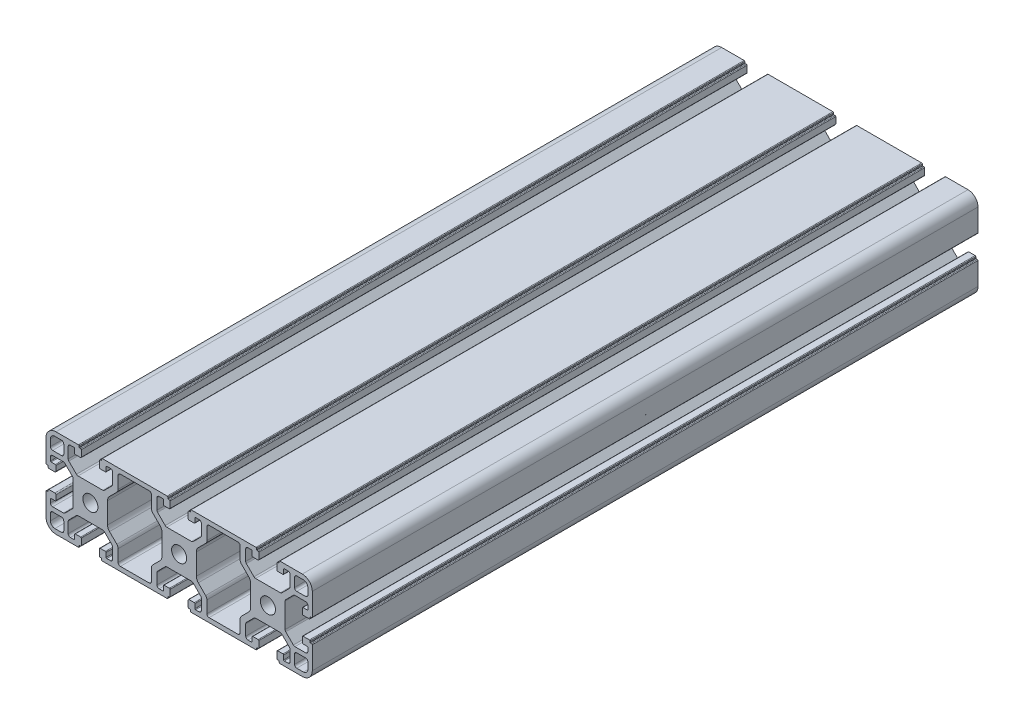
SolidWorks part; units mm, degrees
ref_plane "前视基准面" through (0, 0, 0) normal (0, 0, 1) x (1, 0, 0)
ref_plane "上视基准面" through (0, 0, 0) normal (0, 1, 0) x (1, 0, 0)
ref_plane "右视基准面" through (0, 0, 0) normal (1, 0, 0) x (0, 0, -1)
sketch "草图1" plane through (0, 0, 0) normal (0, 0, 1) x (1, 0, 0)
  line B0 (-34.432, 7.75) -> (-45.568, 7.75)
  line B1 (-46.2751, 8.0429) -> (-49.7071, 11.4749)
  line B2 (-50, 12.182) -> (-50, 17)
  line B3 (-49, 18) -> (-47.1, 18)
  line B4 (-47.1, 18) -> (-47.1, 15.8)
  line B5 (-46.8, 15.5) -> (-44.4, 15.5)
  line B6 (-44.1, 15.8) -> (-44.1, 18.7)
  line B7 (-44.4, 19) -> (-44.9, 19)
  line B8 (-45.1, 19.2) -> (-45.1, 19.7)
  line B9 (-45.4, 20) -> (-55.5, 20)
  line B10 (-60, 15.5) -> (-60, 5.4)
  line B11 (-59.7, 5.1) -> (-59.2, 5.1)
  line B12 (-59, 4.9) -> (-59, 4.4)
  line B13 (-58.7, 4.1) -> (-56, 4.1)
  line B14 (-55.5, 4.6) -> (-55.5, 6.8)
  line B15 (-55.8, 7.1) -> (-57.7, 7.1)
  line B16 (-58, 7.4) -> (-58, 9)
  line B17 (-57, 10) -> (-52.182, 10)
  line B18 (-51.4749, 9.7071) -> (-48.0429, 6.2751)
  line B19 (-47.75, 5.568) -> (-47.75, -5.568)
  line B20 (-48.0429, -6.2751) -> (-51.4749, -9.7071)
  line B21 (-52.182, -10) -> (-57, -10)
  line B22 (-58, -9) -> (-58, -7.4)
  line B23 (-57.7, -7.1) -> (-55.8, -7.1)
  line B24 (-55.5, -6.8) -> (-55.5, -4.6)
  line B25 (-56, -4.1) -> (-58.7, -4.1)
  line B26 (-59, -4.4) -> (-59, -4.9)
  line B27 (-59.2, -5.1) -> (-59.7, -5.1)
  line B28 (-60, -5.4) -> (-60, -15.5)
  line B29 (-55.5, -20) -> (-45.4, -20)
  line B30 (-45.1, -19.7) -> (-45.1, -19.2)
  line B31 (-44.9, -19) -> (-44.4, -19)
  line B32 (-44.1, -18.7) -> (-44.1, -15.8)
  line B33 (-44.4, -15.5) -> (-46.8, -15.5)
  line B34 (-47.1, -15.8) -> (-47.1, -17.7)
  line B35 (-47.4, -18) -> (-49, -18)
  line B36 (-50, -17) -> (-50, -12.182)
  line B37 (-49.7071, -11.4749) -> (-46.2751, -8.0429)
  line B38 (-45.568, -7.75) -> (-34.432, -7.75)
  line B39 (-33.7249, -8.0429) -> (-30.2929, -11.4749)
  line B40 (-30, -12.182) -> (-30, -17)
  line B41 (-31, -18) -> (-32.6, -18)
  line B42 (-32.9, -17.7) -> (-32.9, -15.8)
  line B43 (-33.2, -15.5) -> (-35.6, -15.5)
  line B44 (-35.9, -15.8) -> (-35.9, -18.7)
  line B45 (-35.6, -19) -> (-35.1, -19)
  line B46 (-34.9, -19.2) -> (-34.9, -19.7)
  line B47 (-34.6, -20) -> (-5.4, -20)
  line B48 (-5.1, -19.7) -> (-5.1, -19.2)
  line B49 (-4.9, -19) -> (-4.4, -19)
  line B50 (-4.1, -18.7) -> (-4.1, -15.8)
  line B51 (-4.4, -15.5) -> (-6.8, -15.5)
  line B52 (-7.1, -15.8) -> (-7.1, -17.7)
  line B53 (-7.4, -18) -> (-9, -18)
  line B54 (-10, -17) -> (-10, -12.182)
  line B55 (-9.7071, -11.4749) -> (-6.2751, -8.0429)
  line B56 (-5.568, -7.75) -> (5.568, -7.75)
  line B57 (6.2751, -8.0429) -> (9.7071, -11.4749)
  line B58 (10, -12.182) -> (10, -17)
  line B59 (9, -18) -> (7.4, -18)
  line B60 (7.1, -17.7) -> (7.1, -15.8)
  line B61 (6.8, -15.5) -> (4.4, -15.5)
  line B62 (4.1, -15.8) -> (4.1, -18.7)
  line B63 (4.4, -19) -> (4.9, -19)
  line B64 (5.1, -19.2) -> (5.1, -19.7)
  line B65 (5.4, -20) -> (34.6, -20)
  line B66 (34.9, -19.7) -> (34.9, -19.2)
  line B67 (35.1, -19) -> (35.6, -19)
  line B68 (35.9, -18.7) -> (35.9, -15.8)
  line B69 (35.6, -15.5) -> (33.2, -15.5)
  line B70 (32.9, -15.8) -> (32.9, -17.7)
  line B71 (32.6, -18) -> (31, -18)
  line B72 (30, -17) -> (30, -12.182)
  line B73 (30.2929, -11.4749) -> (33.7249, -8.0429)
  line B74 (34.432, -7.75) -> (45.568, -7.75)
  line B75 (46.2751, -8.0429) -> (49.7071, -11.4749)
  line B76 (50, -12.182) -> (50, -17)
  line B77 (49, -18) -> (47.4, -18)
  line B78 (47.1, -17.7) -> (47.1, -15.8)
  line B79 (46.8, -15.5) -> (44.4, -15.5)
  line B80 (44.1, -15.8) -> (44.1, -18.7)
  line B81 (44.4, -19) -> (44.9, -19)
  line B82 (45.1, -19.2) -> (45.1, -19.7)
  line B83 (45.4, -20) -> (55.5, -20)
  line B84 (60, -15.5) -> (60, -5.4)
  line B85 (59.7, -5.1) -> (59.2, -5.1)
  line B86 (59, -4.9) -> (59, -4.4)
  line B87 (58.7, -4.1) -> (55.8, -4.1)
  line B88 (55.5, -4.4) -> (55.5, -6.8)
  line B89 (55.8, -7.1) -> (57.7, -7.1)
  line B90 (58, -7.4) -> (58, -9)
  line B91 (57, -10) -> (52.182, -10)
  line B92 (51.4749, -9.7071) -> (48.0429, -6.2751)
  line B93 (47.75, -5.568) -> (47.75, 5.568)
  line B94 (48.0429, 6.2751) -> (51.4749, 9.7071)
  line B95 (52.182, 10) -> (57, 10)
  line B96 (58, 9) -> (58, 7.4)
  line B97 (57.7, 7.1) -> (55.8, 7.1)
  line B98 (55.5, 6.8) -> (55.5, 4.4)
  line B99 (55.8, 4.1) -> (58.7, 4.1)
  line B100 (59, 4.4) -> (59, 4.9)
  line B101 (59.2, 5.1) -> (59.7, 5.1)
  line B102 (60, 5.4) -> (60, 15.5)
  line B103 (55.5, 20) -> (45.4, 20)
  line B104 (45.1, 19.7) -> (45.1, 19.2)
  line B105 (44.9, 19) -> (44.4, 19)
  line B106 (44.1, 18.7) -> (44.1, 15.8)
  line B107 (44.4, 15.5) -> (46.8, 15.5)
  line B108 (47.1, 15.8) -> (47.1, 17.7)
  line B109 (47.4, 18) -> (49, 18)
  line B110 (50, 17) -> (50, 12.182)
  line B111 (49.7071, 11.4749) -> (46.2751, 8.0429)
  line B112 (45.568, 7.75) -> (34.432, 7.75)
  line B113 (33.7249, 8.0429) -> (30.2929, 11.4749)
  line B114 (30, 12.182) -> (30, 17)
  line B115 (31, 18) -> (32.6, 18)
  line B116 (32.9, 17.7) -> (32.9, 15.8)
  line B117 (33.2, 15.5) -> (35.6, 15.5)
  line B118 (35.9, 15.8) -> (35.9, 18.7)
  line B119 (35.6, 19) -> (35.1, 19)
  line B120 (34.9, 19.2) -> (34.9, 19.7)
  line B121 (34.6, 20) -> (5.4, 20)
  line B122 (5.1, 19.7) -> (5.1, 19.2)
  line B123 (4.9, 19) -> (4.4, 19)
  line B124 (4.1, 18.7) -> (4.1, 15.8)
  line B125 (4.4, 15.5) -> (6.8, 15.5)
  line B126 (7.1, 15.8) -> (7.1, 17.7)
  line B127 (7.4, 18) -> (9, 18)
  line B128 (10, 17) -> (10, 12.182)
  line B129 (9.7071, 11.4749) -> (6.2751, 8.0429)
  line B130 (5.568, 7.75) -> (-5.568, 7.75)
  line B131 (-6.2751, 8.0429) -> (-9.7071, 11.4749)
  line B132 (-10, 12.182) -> (-10, 17)
  line B133 (-9, 18) -> (-7.4, 18)
  line B134 (-7.1, 17.7) -> (-7.1, 15.8)
  line B135 (-6.8, 15.5) -> (-4.4, 15.5)
  line B136 (-4.1, 15.8) -> (-4.1, 18.7)
  line B137 (-4.4, 19) -> (-4.9, 19)
  line B138 (-5.1, 19.2) -> (-5.1, 19.7)
  line B139 (-5.4, 20) -> (-34.6, 20)
  line B140 (-34.9, 19.7) -> (-34.9, 19.2)
  line B141 (-35.1, 19) -> (-35.6, 19)
  line B142 (-35.9, 18.7) -> (-35.9, 15.8)
  line B143 (-35.6, 15.5) -> (-33.2, 15.5)
  line B144 (-32.9, 15.8) -> (-32.9, 17.7)
  line B145 (-32.6, 18) -> (-31, 18)
  line B146 (-30, 17) -> (-30, 12.182)
  line B147 (-30.2929, 11.4749) -> (-33.7249, 8.0429)
  line B148 (11.9277, 10.1599) -> (8.6287, 6.8609)
  line B149 (7.75, 4.7396) -> (7.75, -4.7396)
  line B150 (8.6287, -6.8609) -> (11.9277, -10.1599)
  line B151 (12.5135, -11.5741) -> (12.5135, -17)
  line B152 (13.5135, -18) -> (26.4865, -18)
  line B153 (27.4865, -17) -> (27.4865, -11.5741)
  line B154 (28.0723, -10.1599) -> (31.3713, -6.8609)
  line B155 (32.25, -4.7396) -> (32.25, 4.7396)
  line B156 (31.3713, 6.8609) -> (28.0723, 10.1599)
  line B157 (27.4865, 11.5741) -> (27.4865, 17)
  line B158 (26.4865, 18) -> (13.5135, 18)
  line B159 (12.5135, 17) -> (12.5135, 11.5741)
  line B160 (-28.0723, 10.1599) -> (-31.3713, 6.8609)
  line B161 (-32.25, 4.7396) -> (-32.25, -4.7396)
  line B162 (-31.3713, -6.8609) -> (-28.0723, -10.1599)
  line B163 (-27.4865, -11.5741) -> (-27.4865, -17)
  line B164 (-26.4865, -18) -> (-13.5135, -18)
  line B165 (-12.5135, -17) -> (-12.5135, -11.5741)
  line B166 (-11.9277, -10.1599) -> (-8.6287, -6.8609)
  line B167 (-7.75, -4.7396) -> (-7.75, 4.7396)
  line B168 (-8.6287, 6.8609) -> (-11.9277, 10.1599)
  line B169 (-12.5135, 11.5741) -> (-12.5135, 17)
  line B170 (-13.5135, 18) -> (-26.4865, 18)
  line B171 (-27.4865, 17) -> (-27.4865, 11.5741)
  line B172 (58, -16) -> (58, -13)
  line B173 (57, -12) -> (53, -12)
  line B174 (52, -13) -> (52, -17)
  line B175 (53, -18) -> (56, -18)
  line B176 (52, 17) -> (52, 13)
  line B177 (53, 12) -> (57, 12)
  line B178 (58, 13) -> (58, 16)
  line B179 (56, 18) -> (53, 18)
  line B180 (-57, 12) -> (-53, 12)
  line B181 (-52, 13) -> (-52, 17)
  line B182 (-53, 18) -> (-56, 18)
  line B183 (-58, 16) -> (-58, 13)
  line B184 (-58, -13) -> (-58, -16)
  line B185 (-56, -18) -> (-53, -18)
  line B186 (-52, -17) -> (-52, -13)
  line B187 (-53, -12) -> (-57, -12)
  arc B188 (-34.432, 7.75) -> (-33.7249, 8.0429) centre (-34.432, 8.75) ccw
  arc B189 (-46.2751, 8.0429) -> (-45.568, 7.75) centre (-45.568, 8.75) ccw
  arc B190 (-50, 12.182) -> (-49.7071, 11.4749) centre (-49, 12.182) ccw
  arc B191 (-49, 18) -> (-50, 17) centre (-49, 17) ccw
  arc B192 (-47.1, 15.8) -> (-46.8, 15.5) centre (-46.8, 15.8) ccw
  arc B193 (-44.4, 15.5) -> (-44.1, 15.8) centre (-44.4, 15.8) ccw
  arc B194 (-44.1, 18.7) -> (-44.4, 19) centre (-44.4, 18.7) ccw
  arc B195 (-45.1, 19.2) -> (-44.9, 19) centre (-44.9, 19.2) ccw
  arc B196 (-45.1, 19.7) -> (-45.4, 20) centre (-45.4, 19.7) ccw
  arc B197 (-55.5, 20) -> (-60, 15.5) centre (-55.5, 15.5) ccw
  arc B198 (-60, 5.4) -> (-59.7, 5.1) centre (-59.7, 5.4) ccw
  arc B199 (-59, 4.9) -> (-59.2, 5.1) centre (-59.2, 4.9) ccw
  arc B200 (-59, 4.4) -> (-58.7, 4.1) centre (-58.7, 4.4) ccw
  arc B201 (-56, 4.1) -> (-55.5, 4.6) centre (-56, 4.6) ccw
  arc B202 (-55.5, 6.8) -> (-55.8, 7.1) centre (-55.8, 6.8) ccw
  arc B203 (-58, 7.4) -> (-57.7, 7.1) centre (-57.7, 7.4) ccw
  arc B204 (-57, 10) -> (-58, 9) centre (-57, 9) ccw
  arc B205 (-51.4749, 9.7071) -> (-52.182, 10) centre (-52.182, 9) ccw
  arc B206 (-47.75, 5.568) -> (-48.0429, 6.2751) centre (-48.75, 5.568) ccw
  arc B207 (-48.0429, -6.2751) -> (-47.75, -5.568) centre (-48.75, -5.568) ccw
  arc B208 (-52.182, -10) -> (-51.4749, -9.7071) centre (-52.182, -9) ccw
  arc B209 (-58, -9) -> (-57, -10) centre (-57, -9) ccw
  arc B210 (-57.7, -7.1) -> (-58, -7.4) centre (-57.7, -7.4) ccw
  arc B211 (-55.8, -7.1) -> (-55.5, -6.8) centre (-55.8, -6.8) ccw
  arc B212 (-55.5, -4.6) -> (-56, -4.1) centre (-56, -4.6) ccw
  arc B213 (-58.7, -4.1) -> (-59, -4.4) centre (-58.7, -4.4) ccw
  arc B214 (-59.2, -5.1) -> (-59, -4.9) centre (-59.2, -4.9) ccw
  arc B215 (-59.7, -5.1) -> (-60, -5.4) centre (-59.7, -5.4) ccw
  arc B216 (-60, -15.5) -> (-55.5, -20) centre (-55.5, -15.5) ccw
  arc B217 (-45.4, -20) -> (-45.1, -19.7) centre (-45.4, -19.7) ccw
  arc B218 (-44.9, -19) -> (-45.1, -19.2) centre (-44.9, -19.2) ccw
  arc B219 (-44.4, -19) -> (-44.1, -18.7) centre (-44.4, -18.7) ccw
  arc B220 (-44.1, -15.8) -> (-44.4, -15.5) centre (-44.4, -15.8) ccw
  arc B221 (-46.8, -15.5) -> (-47.1, -15.8) centre (-46.8, -15.8) ccw
  arc B222 (-47.4, -18) -> (-47.1, -17.7) centre (-47.4, -17.7) ccw
  arc B223 (-50, -17) -> (-49, -18) centre (-49, -17) ccw
  arc B224 (-49.7071, -11.4749) -> (-50, -12.182) centre (-49, -12.182) ccw
  arc B225 (-45.568, -7.75) -> (-46.2751, -8.0429) centre (-45.568, -8.75) ccw
  arc B226 (-33.7249, -8.0429) -> (-34.432, -7.75) centre (-34.432, -8.75) ccw
  arc B227 (-30, -12.182) -> (-30.2929, -11.4749) centre (-31, -12.182) ccw
  arc B228 (-31, -18) -> (-30, -17) centre (-31, -17) ccw
  arc B229 (-32.9, -17.7) -> (-32.6, -18) centre (-32.6, -17.7) ccw
  arc B230 (-32.9, -15.8) -> (-33.2, -15.5) centre (-33.2, -15.8) ccw
  arc B231 (-35.6, -15.5) -> (-35.9, -15.8) centre (-35.6, -15.8) ccw
  arc B232 (-35.9, -18.7) -> (-35.6, -19) centre (-35.6, -18.7) ccw
  arc B233 (-34.9, -19.2) -> (-35.1, -19) centre (-35.1, -19.2) ccw
  arc B234 (-34.9, -19.7) -> (-34.6, -20) centre (-34.6, -19.7) ccw
  arc B235 (-5.4, -20) -> (-5.1, -19.7) centre (-5.4, -19.7) ccw
  arc B236 (-4.9, -19) -> (-5.1, -19.2) centre (-4.9, -19.2) ccw
  arc B237 (-4.4, -19) -> (-4.1, -18.7) centre (-4.4, -18.7) ccw
  arc B238 (-4.1, -15.8) -> (-4.4, -15.5) centre (-4.4, -15.8) ccw
  arc B239 (-6.8, -15.5) -> (-7.1, -15.8) centre (-6.8, -15.8) ccw
  arc B240 (-7.4, -18) -> (-7.1, -17.7) centre (-7.4, -17.7) ccw
  arc B241 (-10, -17) -> (-9, -18) centre (-9, -17) ccw
  arc B242 (-9.7071, -11.4749) -> (-10, -12.182) centre (-9, -12.182) ccw
  arc B243 (-5.568, -7.75) -> (-6.2751, -8.0429) centre (-5.568, -8.75) ccw
  arc B244 (6.2751, -8.0429) -> (5.568, -7.75) centre (5.568, -8.75) ccw
  arc B245 (10, -12.182) -> (9.7071, -11.4749) centre (9, -12.182) ccw
  arc B246 (9, -18) -> (10, -17) centre (9, -17) ccw
  arc B247 (7.1, -17.7) -> (7.4, -18) centre (7.4, -17.7) ccw
  arc B248 (7.1, -15.8) -> (6.8, -15.5) centre (6.8, -15.8) ccw
  arc B249 (4.4, -15.5) -> (4.1, -15.8) centre (4.4, -15.8) ccw
  arc B250 (4.1, -18.7) -> (4.4, -19) centre (4.4, -18.7) ccw
  arc B251 (5.1, -19.2) -> (4.9, -19) centre (4.9, -19.2) ccw
  arc B252 (5.1, -19.7) -> (5.4, -20) centre (5.4, -19.7) ccw
  arc B253 (34.6, -20) -> (34.9, -19.7) centre (34.6, -19.7) ccw
  arc B254 (35.1, -19) -> (34.9, -19.2) centre (35.1, -19.2) ccw
  arc B255 (35.6, -19) -> (35.9, -18.7) centre (35.6, -18.7) ccw
  arc B256 (35.9, -15.8) -> (35.6, -15.5) centre (35.6, -15.8) ccw
  arc B257 (33.2, -15.5) -> (32.9, -15.8) centre (33.2, -15.8) ccw
  arc B258 (32.6, -18) -> (32.9, -17.7) centre (32.6, -17.7) ccw
  arc B259 (30, -17) -> (31, -18) centre (31, -17) ccw
  arc B260 (30.2929, -11.4749) -> (30, -12.182) centre (31, -12.182) ccw
  arc B261 (34.432, -7.75) -> (33.7249, -8.0429) centre (34.432, -8.75) ccw
  arc B262 (46.2751, -8.0429) -> (45.568, -7.75) centre (45.568, -8.75) ccw
  arc B263 (50, -12.182) -> (49.7071, -11.4749) centre (49, -12.182) ccw
  arc B264 (49, -18) -> (50, -17) centre (49, -17) ccw
  arc B265 (47.1, -17.7) -> (47.4, -18) centre (47.4, -17.7) ccw
  arc B266 (47.1, -15.8) -> (46.8, -15.5) centre (46.8, -15.8) ccw
  arc B267 (44.4, -15.5) -> (44.1, -15.8) centre (44.4, -15.8) ccw
  arc B268 (44.1, -18.7) -> (44.4, -19) centre (44.4, -18.7) ccw
  arc B269 (45.1, -19.2) -> (44.9, -19) centre (44.9, -19.2) ccw
  arc B270 (45.1, -19.7) -> (45.4, -20) centre (45.4, -19.7) ccw
  arc B271 (55.5, -20) -> (60, -15.5) centre (55.5, -15.5) ccw
  arc B272 (60, -5.4) -> (59.7, -5.1) centre (59.7, -5.4) ccw
  arc B273 (59, -4.9) -> (59.2, -5.1) centre (59.2, -4.9) ccw
  arc B274 (59, -4.4) -> (58.7, -4.1) centre (58.7, -4.4) ccw
  arc B275 (55.8, -4.1) -> (55.5, -4.4) centre (55.8, -4.4) ccw
  arc B276 (55.5, -6.8) -> (55.8, -7.1) centre (55.8, -6.8) ccw
  arc B277 (58, -7.4) -> (57.7, -7.1) centre (57.7, -7.4) ccw
  arc B278 (57, -10) -> (58, -9) centre (57, -9) ccw
  arc B279 (51.4749, -9.7071) -> (52.182, -10) centre (52.182, -9) ccw
  arc B280 (47.75, -5.568) -> (48.0429, -6.2751) centre (48.75, -5.568) ccw
  arc B281 (48.0429, 6.2751) -> (47.75, 5.568) centre (48.75, 5.568) ccw
  arc B282 (52.182, 10) -> (51.4749, 9.7071) centre (52.182, 9) ccw
  arc B283 (58, 9) -> (57, 10) centre (57, 9) ccw
  arc B284 (57.7, 7.1) -> (58, 7.4) centre (57.7, 7.4) ccw
  arc B285 (55.8, 7.1) -> (55.5, 6.8) centre (55.8, 6.8) ccw
  arc B286 (55.5, 4.4) -> (55.8, 4.1) centre (55.8, 4.4) ccw
  arc B287 (58.7, 4.1) -> (59, 4.4) centre (58.7, 4.4) ccw
  arc B288 (59.2, 5.1) -> (59, 4.9) centre (59.2, 4.9) ccw
  arc B289 (59.7, 5.1) -> (60, 5.4) centre (59.7, 5.4) ccw
  arc B290 (60, 15.5) -> (55.5, 20) centre (55.5, 15.5) ccw
  arc B291 (45.4, 20) -> (45.1, 19.7) centre (45.4, 19.7) ccw
  arc B292 (44.9, 19) -> (45.1, 19.2) centre (44.9, 19.2) ccw
  arc B293 (44.4, 19) -> (44.1, 18.7) centre (44.4, 18.7) ccw
  arc B294 (44.1, 15.8) -> (44.4, 15.5) centre (44.4, 15.8) ccw
  arc B295 (46.8, 15.5) -> (47.1, 15.8) centre (46.8, 15.8) ccw
  arc B296 (47.4, 18) -> (47.1, 17.7) centre (47.4, 17.7) ccw
  arc B297 (50, 17) -> (49, 18) centre (49, 17) ccw
  arc B298 (49.7071, 11.4749) -> (50, 12.182) centre (49, 12.182) ccw
  arc B299 (45.568, 7.75) -> (46.2751, 8.0429) centre (45.568, 8.75) ccw
  arc B300 (33.7249, 8.0429) -> (34.432, 7.75) centre (34.432, 8.75) ccw
  arc B301 (30, 12.182) -> (30.2929, 11.4749) centre (31, 12.182) ccw
  arc B302 (31, 18) -> (30, 17) centre (31, 17) ccw
  arc B303 (32.9, 17.7) -> (32.6, 18) centre (32.6, 17.7) ccw
  arc B304 (32.9, 15.8) -> (33.2, 15.5) centre (33.2, 15.8) ccw
  arc B305 (35.6, 15.5) -> (35.9, 15.8) centre (35.6, 15.8) ccw
  arc B306 (35.9, 18.7) -> (35.6, 19) centre (35.6, 18.7) ccw
  arc B307 (34.9, 19.2) -> (35.1, 19) centre (35.1, 19.2) ccw
  arc B308 (34.9, 19.7) -> (34.6, 20) centre (34.6, 19.7) ccw
  arc B309 (5.4, 20) -> (5.1, 19.7) centre (5.4, 19.7) ccw
  arc B310 (4.9, 19) -> (5.1, 19.2) centre (4.9, 19.2) ccw
  arc B311 (4.4, 19) -> (4.1, 18.7) centre (4.4, 18.7) ccw
  arc B312 (4.1, 15.8) -> (4.4, 15.5) centre (4.4, 15.8) ccw
  arc B313 (6.8, 15.5) -> (7.1, 15.8) centre (6.8, 15.8) ccw
  arc B314 (7.4, 18) -> (7.1, 17.7) centre (7.4, 17.7) ccw
  arc B315 (10, 17) -> (9, 18) centre (9, 17) ccw
  arc B316 (9.7071, 11.4749) -> (10, 12.182) centre (9, 12.182) ccw
  arc B317 (5.568, 7.75) -> (6.2751, 8.0429) centre (5.568, 8.75) ccw
  arc B318 (-6.2751, 8.0429) -> (-5.568, 7.75) centre (-5.568, 8.75) ccw
  arc B319 (-10, 12.182) -> (-9.7071, 11.4749) centre (-9, 12.182) ccw
  arc B320 (-9, 18) -> (-10, 17) centre (-9, 17) ccw
  arc B321 (-7.1, 17.7) -> (-7.4, 18) centre (-7.4, 17.7) ccw
  arc B322 (-7.1, 15.8) -> (-6.8, 15.5) centre (-6.8, 15.8) ccw
  arc B323 (-4.4, 15.5) -> (-4.1, 15.8) centre (-4.4, 15.8) ccw
  arc B324 (-4.1, 18.7) -> (-4.4, 19) centre (-4.4, 18.7) ccw
  arc B325 (-5.1, 19.2) -> (-4.9, 19) centre (-4.9, 19.2) ccw
  arc B326 (-5.1, 19.7) -> (-5.4, 20) centre (-5.4, 19.7) ccw
  arc B327 (-34.6, 20) -> (-34.9, 19.7) centre (-34.6, 19.7) ccw
  arc B328 (-35.1, 19) -> (-34.9, 19.2) centre (-35.1, 19.2) ccw
  arc B329 (-35.6, 19) -> (-35.9, 18.7) centre (-35.6, 18.7) ccw
  arc B330 (-35.9, 15.8) -> (-35.6, 15.5) centre (-35.6, 15.8) ccw
  arc B331 (-33.2, 15.5) -> (-32.9, 15.8) centre (-33.2, 15.8) ccw
  arc B332 (-32.6, 18) -> (-32.9, 17.7) centre (-32.6, 17.7) ccw
  arc B333 (-30, 17) -> (-31, 18) centre (-31, 17) ccw
  arc B334 (-30.2929, 11.4749) -> (-30, 12.182) centre (-31, 12.182) ccw
  arc B335 (8.6287, 6.8609) -> (7.75, 4.7396) centre (10.75, 4.7396) ccw
  arc B336 (7.75, -4.7396) -> (8.6287, -6.8609) centre (10.75, -4.7396) ccw
  arc B337 (12.5135, -11.5741) -> (11.9277, -10.1599) centre (10.5135, -11.5741) ccw
  arc B338 (12.5135, -17) -> (13.5135, -18) centre (13.5135, -17) ccw
  arc B339 (26.4865, -18) -> (27.4865, -17) centre (26.4865, -17) ccw
  arc B340 (28.0723, -10.1599) -> (27.4865, -11.5741) centre (29.4865, -11.5741) ccw
  arc B341 (31.3713, -6.8609) -> (32.25, -4.7396) centre (29.25, -4.7396) ccw
  arc B342 (32.25, 4.7396) -> (31.3713, 6.8609) centre (29.25, 4.7396) ccw
  arc B343 (27.4865, 11.5741) -> (28.0723, 10.1599) centre (29.4865, 11.5741) ccw
  arc B344 (27.4865, 17) -> (26.4865, 18) centre (26.4865, 17) ccw
  arc B345 (13.5135, 18) -> (12.5135, 17) centre (13.5135, 17) ccw
  arc B346 (11.9277, 10.1599) -> (12.5135, 11.5741) centre (10.5135, 11.5741) ccw
  arc B347 (-31.3713, 6.8609) -> (-32.25, 4.7396) centre (-29.25, 4.7396) ccw
  arc B348 (-32.25, -4.7396) -> (-31.3713, -6.8609) centre (-29.25, -4.7396) ccw
  arc B349 (-27.4865, -11.5741) -> (-28.0723, -10.1599) centre (-29.4865, -11.5741) ccw
  arc B350 (-27.4865, -17) -> (-26.4865, -18) centre (-26.4865, -17) ccw
  arc B351 (-13.5135, -18) -> (-12.5135, -17) centre (-13.5135, -17) ccw
  arc B352 (-11.9277, -10.1599) -> (-12.5135, -11.5741) centre (-10.5135, -11.5741) ccw
  arc B353 (-8.6287, -6.8609) -> (-7.75, -4.7396) centre (-10.75, -4.7396) ccw
  arc B354 (-7.75, 4.7396) -> (-8.6287, 6.8609) centre (-10.75, 4.7396) ccw
  arc B355 (-12.5135, 11.5741) -> (-11.9277, 10.1599) centre (-10.5135, 11.5741) ccw
  arc B356 (-12.5135, 17) -> (-13.5135, 18) centre (-13.5135, 17) ccw
  arc B357 (-26.4865, 18) -> (-27.4865, 17) centre (-26.4865, 17) ccw
  arc B358 (-28.0723, 10.1599) -> (-27.4865, 11.5741) centre (-29.4865, 11.5741) ccw
  arc B359 (58, -13) -> (57, -12) centre (57, -13) ccw
  arc B360 (53, -12) -> (52, -13) centre (53, -13) ccw
  arc B361 (52, -17) -> (53, -18) centre (53, -17) ccw
  arc B362 (56, -18) -> (58, -16) centre (56, -16) ccw
  arc B363 (53, 18) -> (52, 17) centre (53, 17) ccw
  arc B364 (52, 13) -> (53, 12) centre (53, 13) ccw
  arc B365 (57, 12) -> (58, 13) centre (57, 13) ccw
  arc B366 (58, 16) -> (56, 18) centre (56, 16) ccw
  arc B367 (-53, 12) -> (-52, 13) centre (-53, 13) ccw
  arc B368 (-52, 17) -> (-53, 18) centre (-53, 17) ccw
  arc B369 (-56, 18) -> (-58, 16) centre (-56, 16) ccw
  arc B370 (-58, 13) -> (-57, 12) centre (-57, 13) ccw
  arc B371 (-57, -12) -> (-58, -13) centre (-57, -13) ccw
  arc B372 (-58, -16) -> (-56, -18) centre (-56, -16) ccw
  arc B373 (-53, -18) -> (-52, -17) centre (-53, -17) ccw
  arc B374 (-52, -13) -> (-53, -12) centre (-53, -13) ccw
  circle B375 centre (40, 0) radius 3.4
  circle B376 centre (0, 0) radius 3.4
  circle B377 centre (-40, 0) radius 3.4
sketch_block_instance "A$C555862BC-1"
sketch_block "A$C555862BC"
extrude "凸台-拉伸1" add sketch "草图1" along normal mid plane 300
